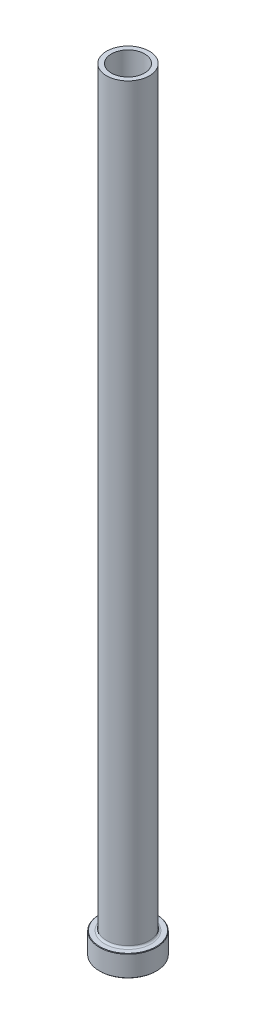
SolidWorks part; units mm, degrees
ref_plane "Front Plane" through (0, 0, 0) normal (0, 0, 1) x (1, 0, 0)
ref_plane "Top Plane" through (0, 0, 0) normal (0, 1, 0) x (1, 0, 0)
ref_plane "Right Plane" through (0, 0, 0) normal (1, 0, 0) x (0, 0, -1)
sketch "Sketch1" plane through (0, 0, 0) normal (0, 0, 1) x (1, 0, 0)
  line L0 (-7, 325) -> (-9, 325)
  line L1 (-9, 325) -> (-9, 9)
  line L2 (-9, 9) -> (-12, 9)
  line L3 (-12, 9) -> (-12, 0)
  line L4 (13.2, 0) -> (-13.2, 0) construction
  line L5 (-12, 0) -> (-7.25, 0)
  line L6 (-7, 270) -> (-7, 325)
  line L7 (0, 92.1877) -> (0, -15.5353) construction
  line L8 (0, -13.2) -> (0, 13.2) construction
  line L9 (-7, 270) -> (-7.25, 258)
  line L10 (-7.25, 258) -> (-7.25, 0)
  dimension "D1" = 0.25
  dimension "ID" = 14
  dimension "OD" = 18
  dimension "L" = 325
  dimension "H" = 24
  dimension "T" = 9
  dimension "N" = 55
  dimension "D2" = 12
revolve "Revolve1" add sketch "Sketch1" angle 360 about L7
fillet "Fillet1" radius 0.8 1 edges at (0, 9, 9)
chamfer "Chamfer1" distance 0.2 angle 45 2 edges at (0, 9, 12) (0, 0, 12)
chamfer "Chamfer3" distance 0.5 angle 45 1 edges at (0, 0, 7.25)
